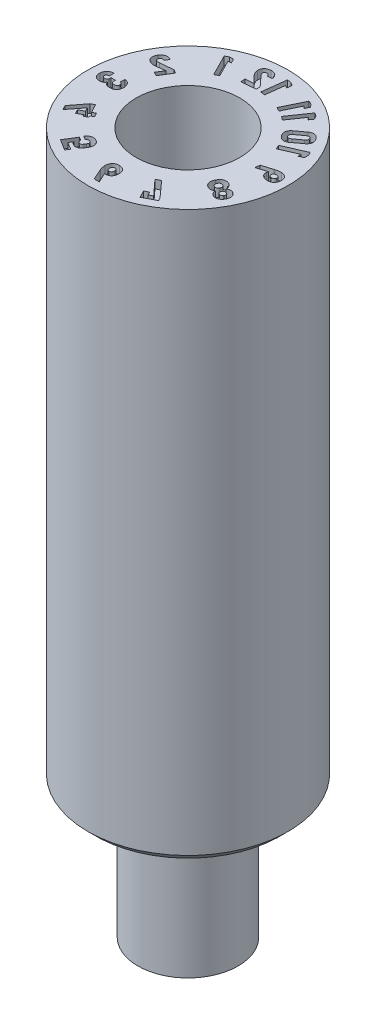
SolidWorks part; units mm, degrees
other "<M3L8-SetScrew>-<Chamfer1>" parameters "D10"=0.24
ref_plane "Front Plane" through (0, 0, 0) normal (0, 0, 1) x (1, 0, 0)
ref_plane "Top Plane" through (0, 0, 0) normal (0, 1, 0) x (1, 0, 0)
ref_plane "Right Plane" through (0, 0, 0) normal (1, 0, 0) x (0, 0, -1)
sketch "Sketch1" plane through (0, 0, 0) normal (0, 0, 1) x (1, 0, 0)
  line L0 (0, 0) -> (0, 20) construction
  line L1 (0, -11) -> (0, 11) construction
  line L2 (1.5, -17) -> (2.76, -17)
  line L4 (3, -16.76) -> (3, 0)
  line L5 (3, 0) -> (1.55, 0)
  line L6 (1.55, 0) -> (1.55, -2.8)
  line L7 (1.55, -2.8) -> (0.8, -2.8)
  line L8 (0.8, -2.8) -> (0.8, -13)
  line L9 (0.8, -13) -> (1.5, -13)
  line L10 (1.5, -13) -> (1.5, -17)
  line L11 (2.76, -17) -> (3, -16.76)
  point P6 (3, -17)
  dimension "D1" = 2.8
  dimension "D2" = 4
  dimension "D3" = 1.6
  dimension "D4" = 3.1
  dimension "D5" = 6
  dimension "D6" = 3
  dimension "D7" = 17
revolve "Revolve1" add sketch "Sketch1" angle 360 about L0
sketch "Sketch2" plane through (0, 0, 0) normal (0, 1, 0) x (1, 0, 0)
  line L0 (0, 0) -> (0, 2.1482) construction
  line L1 (0, 0) -> (1.0741, 1.8604) construction
  line L2 (0, 0) -> (1.8604, 1.0741) construction
  line L3 (0, 0) -> (2.1482, 0) construction
  line L4 (0, 0) -> (1.8604, -1.0741) construction
  line L5 (0, 0) -> (1.0741, -1.8604) construction
  line L6 (0, 0) -> (0, -2.1482) construction
  line L7 (0, 0) -> (-1.0741, -1.8604) construction
  line L8 (0, 0) -> (-1.8604, -1.0741) construction
  line L9 (0, 0) -> (-2.1482, 0) construction
  line L10 (0, 0) -> (-1.8604, 1.0741) construction
  line L11 (0, 0) -> (-1.0741, 1.8604) construction
  line L12 (-0.2616, -2.2179) -> (-0.2616, -2.2184)
  line L13 (-0.2164, -2.4193) -> (-0.0775, -2.7325)
  line L14 (-0.0775, -2.7325) -> (0.076, -2.7361)
  line L15 (0.076, -2.7361) -> (-0.0593, -2.4381)
  line L17 (0.1597, -2.2307) -> (0.1597, -2.2302)
  line L18 (0.0243, -2.2186) -> (0.0242, -2.2191)
  line L19 (-0.1259, -2.2151) -> (-0.1258, -2.2146)
  line L20 (1.4101, -2.2492) -> (0.9731, -1.7642)
  line L21 (0.9731, -1.7642) -> (0.8422, -1.8326)
  line L22 (0.8422, -1.8326) -> (1.2559, -2.2838)
  line L23 (1.2559, -2.2838) -> (1.1458, -2.3415)
  line L24 (1.1458, -2.3415) -> (1.0953, -2.245)
  line L25 (1.0953, -2.245) -> (0.9747, -2.3083)
  line L26 (0.9747, -2.3083) -> (1.0861, -2.521)
  line L27 (1.0861, -2.521) -> (1.4521, -2.3294)
  line L28 (1.4521, -2.3294) -> (1.4101, -2.2492)
  line L29 (1.8365, -1.236) -> (1.8469, -1.2415)
  line L30 (2.1309, -1.3756) -> (2.1474, -1.3844)
  line L31 (2.3472, -1.0088) -> (2.3306, -1)
  line L32 (2.0605, -0.8397) -> (2.0501, -0.8342)
  line L33 (2.004, -0.963) -> (2.0101, -0.9661)
  line L34 (1.9231, -1.1287) -> (1.9165, -1.1253)
  line L35 (2.2623, -1.1171) -> (2.2683, -1.1202)
  line L36 (2.1953, -1.2568) -> (2.1888, -1.2534)
  line L38 (2.5285, -0.1797) -> (2.5289, -0.1798)
  line L39 (2.5667, 0.2381) -> (2.5663, 0.2381)
  line L40 (2.3677, 0.2067) -> (2.0498, 0.1085)
  line L41 (2.0498, 0.1085) -> (2.0361, -0.0337)
  line L42 (2.0361, -0.0337) -> (2.348, 0.0684)
  line L43 (2.5596, 0.1032) -> (2.5602, 0.103)
  line L44 (2.5454, -0.0455) -> (2.5449, -0.0455)
  line L45 (1.814, 0.8994) -> (1.8691, 0.775)
  line L46 (1.8691, 0.775) -> (2.3826, 1.0024)
  line L47 (2.3826, 1.0024) -> (2.3878, 0.9088)
  line L48 (2.3878, 0.9088) -> (2.5198, 0.9672)
  line L49 (2.5198, 0.9672) -> (2.5207, 1.0852)
  line L50 (2.5207, 1.0852) -> (2.4737, 1.1913)
  line L51 (2.4737, 1.1913) -> (1.814, 0.8994)
  line L52 (1.903, 1.1411) -> (2.167, 1.3365)
  line L53 (1.9098, 1.6842) -> (1.6458, 1.4888)
  line L54 (1.7547, 1.4001) -> (1.9629, 1.5541)
  line L55 (2.0582, 1.4254) -> (1.8499, 1.2713)
  line L56 (1.1048, 1.6921) -> (1.2166, 1.6145)
  line L57 (1.2166, 1.6145) -> (1.5375, 2.0767)
  line L58 (1.5375, 2.0767) -> (1.5907, 1.9989)
  line L59 (1.5907, 1.9989) -> (1.6733, 2.1178)
  line L60 (1.6733, 2.1178) -> (1.6124, 2.2193)
  line L61 (1.6124, 2.2193) -> (1.5169, 2.2856)
  line L62 (1.5169, 2.2856) -> (1.1048, 1.6921)
  line L63 (0.8091, 1.8542) -> (0.9319, 1.7951)
  line L64 (0.9319, 1.7951) -> (1.1761, 2.3024)
  line L65 (1.1761, 2.3024) -> (1.241, 2.2342)
  line L66 (1.241, 2.2342) -> (1.3039, 2.3646)
  line L67 (1.3039, 2.3646) -> (1.2276, 2.4553)
  line L68 (1.2276, 2.4553) -> (1.1228, 2.5058)
  line L69 (1.1228, 2.5058) -> (0.8091, 1.8542)
  line L70 (0.1607, 2.0186) -> (0.2951, 2.002)
  line L71 (0.2951, 2.002) -> (0.3642, 2.5573)
  line L72 (0.3642, 2.5573) -> (0.447, 2.5135)
  line L73 (0.447, 2.5135) -> (0.4647, 2.6562)
  line L74 (0.4647, 2.6562) -> (0.3642, 2.7176)
  line L75 (0.3642, 2.7176) -> (0.2495, 2.7319)
  line L76 (0.2495, 2.7319) -> (0.1607, 2.0186)
  line L77 (0.0152, 2.146) -> (-0.2613, 2.4483)
  line L78 (-0.3043, 2.5326) -> (-0.3044, 2.5337)
  line L79 (-0.1503, 2.5238) -> (-0.1502, 2.5232)
  line L80 (-0.1502, 2.5232) -> (-0.0111, 2.5358)
  line L81 (-0.0111, 2.5358) -> (-0.0112, 2.5363)
  line L82 (-0.4445, 2.5249) -> (-0.4444, 2.5244)
  line L83 (-0.3627, 2.3458) -> (-0.1653, 2.1379)
  line L84 (-0.1653, 2.1379) -> (-0.4113, 2.1155)
  line L85 (-0.4113, 2.1155) -> (-0.3993, 1.9848)
  line L86 (-0.3993, 1.9848) -> (0.0264, 2.0236)
  line L87 (0.0264, 2.0236) -> (0.0152, 2.146)
  line L88 (-0.9942, 1.7639) -> (-0.8736, 1.8252)
  line L89 (-0.8736, 1.8252) -> (-1.1266, 2.3234)
  line L90 (-1.1266, 2.3234) -> (-1.0338, 2.3335)
  line L91 (-1.0338, 2.3335) -> (-1.0988, 2.4615)
  line L92 (-1.0988, 2.4615) -> (-1.2162, 2.4561)
  line L93 (-1.2162, 2.4561) -> (-1.3192, 2.4038)
  line L94 (-1.3192, 2.4038) -> (-0.9942, 1.7639)
  line L95 (-1.7103, 1.2951) -> (-2.1158, 1.2558)
  line L96 (-2.2086, 1.2719) -> (-2.2095, 1.2724)
  line L97 (-2.1097, 1.389) -> (-2.1093, 1.3888)
  line L98 (-2.1093, 1.3888) -> (-2.0362, 1.5069)
  line L99 (-2.0362, 1.5069) -> (-2.0367, 1.5072)
  line L100 (-2.2861, 1.1559) -> (-2.2857, 1.1556)
  line L101 (-2.0949, 1.1139) -> (-1.8118, 1.1471)
  line L102 (-1.8118, 1.1471) -> (-1.9408, 0.938)
  line L103 (-1.9408, 0.938) -> (-1.8298, 0.8694)
  line L104 (-1.8298, 0.8694) -> (-1.6065, 1.231)
  line L105 (-1.6065, 1.231) -> (-1.7103, 1.2951)
  line L106 (-2.1972, 0.3095) -> (-2.2021, 0.1694)
  line L107 (-2.22, 0.0132) -> (-2.2369, 0.0138)
  line L108 (-2.3203, 0.0827) -> (-2.318, 0.1436)
  line L109 (-2.318, 0.1436) -> (-2.4488, 0.1482)
  line L110 (-2.4488, 0.1482) -> (-2.451, 0.0873)
  line L111 (-2.5271, 0.0359) -> (-2.5396, 0.0364)
  line L112 (-2.5245, 0.1693) -> (-2.5195, 0.309)
  line L113 (-2.5585, -0.1087) -> (-2.5368, -0.1094)
  line L114 (-2.2316, -0.1321) -> (-2.2098, -0.1329)
  line L115 (-2.0917, -0.8458) -> (-2.4153, -1.2665)
  line L116 (-2.4153, -1.2665) -> (-2.344, -1.4017)
  line L117 (-2.344, -1.4017) -> (-2.0228, -0.9891)
  line L118 (-2.0228, -0.9891) -> (-1.9618, -1.1047)
  line L119 (-1.8725, -1.2739) -> (-1.7573, -1.2132)
  line L120 (-1.7573, -1.2132) -> (-1.7834, -1.1636)
  line L121 (-1.9817, -0.7879) -> (-2.0917, -0.8458)
  line L122 (-2.1223, -1.1894) -> (-2.0593, -1.309)
  line L123 (-2.0593, -1.309) -> (-1.8987, -1.2244)
  line L124 (-1.6857, -1.1121) -> (-1.7488, -0.9924)
  line L125 (-1.7488, -0.9924) -> (-1.8466, -1.0439)
  line L126 (-1.3439, -1.7787) -> (-1.344, -1.779)
  line L127 (-1.344, -1.779) -> (-1.2284, -1.8501)
  line L128 (-1.2284, -1.8501) -> (-1.2282, -1.8498)
  line L129 (-1.1017, -1.934) -> (-1.1334, -1.9855)
  line L130 (-1.2738, -1.9369) -> (-1.3817, -1.8705)
  line L131 (-1.3817, -1.8705) -> (-1.5986, -2.223)
  line L132 (-1.5986, -2.223) -> (-1.2694, -2.4257)
  line L133 (-1.2694, -2.4257) -> (-1.2009, -2.3144)
  line L134 (-1.2009, -2.3144) -> (-1.4146, -2.1828)
  line L135 (-1.4146, -2.1828) -> (-1.3479, -2.0743)
  line L136 (-1.0177, -2.0566) -> (-0.986, -2.0051)
  line L137 (-1.8466, -1.0439) -> (-1.9817, -0.7879)
  line L138 (-1.7834, -1.1636) -> (-1.6857, -1.1121)
  line L139 (-1.8987, -1.2244) -> (-1.8725, -1.2739)
  line L140 (-1.9618, -1.1047) -> (-2.1223, -1.1894)
  circle A0 centre (0, 0) radius 2.03 construction
  spline S0 degree 3 poles (-0.0461, -2.0054) (-0.0667, -2.0048) (-0.0971, -2.0069) (-0.1351, -2.017) (-0.1604, -2.0276) (-0.1832, -2.0413) (-0.2032, -2.0583) (-0.2205, -2.0781) (-0.2348, -2.101) (-0.2464, -2.1265) (-0.2578, -2.1654) (-0.261, -2.1966) (-0.2616, -2.2179) knots 0 0 0 0 0.180487 0.262905 0.341887 0.419019 0.494168 0.569775 0.647705 0.728495 0.813324 1 1 1 1
  spline S1 degree 3 poles (-0.2616, -2.2184) (-0.262, -2.2318) (-0.2611, -2.2524) (-0.2578, -2.2801) (-0.2502, -2.3245) (-0.2392, -2.361) (-0.2285, -2.3896) knots 0 0 0 0 0.23009 0.351367 0.476379 1 1 1 1
  spline S2 degree 3 poles (-0.2285, -2.3896) (-0.2266, -2.3946) (-0.2226, -2.4045) (-0.2186, -2.4144) (-0.2164, -2.4193) knots 0 0 0 0 0.502223 1 1 1 1
  spline S3 degree 3 poles (-0.0593, -2.4381) (-0.0507, -2.4401) (-0.0418, -2.441) (-0.0329, -2.4412) knots 0.756686 0.756686 0.756686 0.756686 1 1 1 1
  spline S4 degree 3 poles (-0.0329, -2.4412) (-0.0145, -2.4415) (0.0128, -2.4397) (0.0468, -2.4296) (0.0694, -2.419) (0.0896, -2.4053) (0.1076, -2.3886) (0.1229, -2.3688) (0.1359, -2.3463) (0.1459, -2.3209) (0.1562, -2.2825) (0.1592, -2.2517) (0.1597, -2.2307) knots 0 0 0 0 0.171279 0.250478 0.326847 0.401564 0.476177 0.552821 0.63221 0.716132 0.804689 1 1 1 1
  spline S5 degree 3 poles (0.1597, -2.2302) (0.1603, -2.2086) (0.1583, -2.1771) (0.1488, -2.1372) (0.1385, -2.1108) (0.1253, -2.087) (0.1089, -2.0661) (0.0897, -2.048) (0.0675, -2.0332) (0.0428, -2.0211) (0.005, -2.0094) (-0.0253, -2.0059) (-0.0461, -2.0054) knots 0 0 0 0 0.187076 0.27229 0.35342 0.43179 0.507436 0.58253 0.658929 0.73766 0.820035 1 1 1 1
  spline S6 degree 3 poles (-0.0492, -2.1361) (-0.0384, -2.1364) (-0.0225, -2.1386) (-0.0043, -2.1484) (0.0065, -2.1581) (0.0148, -2.1702) (0.023, -2.1902) (0.0244, -2.2071) (0.0243, -2.2186) knots 0 0 0 0 0.259294 0.374786 0.487745 0.602728 0.722941 1 1 1 1
  spline S7 degree 3 poles (0.0242, -2.2191) (0.0238, -2.2323) (0.0217, -2.2515) (0.0126, -2.2741) (0.0037, -2.2875) (-0.0076, -2.2979) (-0.0261, -2.3082) (-0.0424, -2.3102) (-0.0533, -2.31) knots 0 0 0 0 0.294554 0.41993 0.536573 0.647616 0.758511 1 1 1 1
  spline S8 degree 3 poles (-0.0533, -2.31) (-0.064, -2.3097) (-0.08, -2.3068) (-0.0978, -2.2955) (-0.1085, -2.2843) (-0.1168, -2.2704) (-0.1248, -2.2474) (-0.1261, -2.2283) (-0.1259, -2.2151) knots 0 0 0 0 0.240392 0.350327 0.462502 0.581497 0.70716 1 1 1 1
  spline S9 degree 3 poles (-0.1258, -2.2146) (-0.1254, -2.2031) (-0.1236, -2.1862) (-0.1142, -2.1669) (-0.1054, -2.1553) (-0.0942, -2.1462) (-0.0757, -2.1376) (-0.0599, -2.1359) (-0.0492, -2.1361) knots 0 0 0 0 0.278086 0.398319 0.51325 0.626627 0.741414 1 1 1 1
  spline S10 degree 3 poles (1.7672, -0.9415) (1.757, -0.9603) (1.7449, -0.9895) (1.7353, -1.0295) (1.7322, -1.0583) (1.7328, -1.0862) (1.7369, -1.113) (1.7449, -1.1383) (1.7565, -1.1621) (1.7716, -1.1842) (1.7966, -1.2112) (1.8198, -1.2271) (1.8365, -1.236) knots 0 0 0 0 0.18897 0.276486 0.361509 0.443508 0.521971 0.599279 0.676736 0.754734 0.833659 1 1 1 1
  spline S11 degree 3 poles (1.8469, -1.2415) (1.8625, -1.2497) (1.8876, -1.2592) (1.9231, -1.2636) (1.9502, -1.2634) (1.9772, -1.2597) (2.0119, -1.2499) (2.0359, -1.2372) (2.0503, -1.2266) knots 0 0 0 0 0.246329 0.370315 0.497535 0.62533 0.749846 1 1 1 1
  spline S12 degree 3 poles (2.0503, -1.2266) (2.0498, -1.2419) (2.0518, -1.2649) (2.0607, -1.294) (2.0702, -1.3146) (2.0821, -1.3337) (2.1008, -1.3559) (2.1182, -1.369) (2.1309, -1.3756) knots 0 0 0 0 0.257651 0.384184 0.511783 0.638602 0.760307 1 1 1 1
  spline S13 degree 3 poles (2.1474, -1.3844) (2.1631, -1.3928) (2.1877, -1.4026) (2.2219, -1.4081) (2.247, -1.4081) (2.2718, -1.4048) (2.2959, -1.3978) (2.319, -1.3872) (2.341, -1.3731) (2.3619, -1.3558) (2.3882, -1.3278) (2.4042, -1.303) (2.4136, -1.2853) knots 0 0 0 0 0.16683 0.245777 0.324096 0.401918 0.4796 0.558252 0.640011 0.724439 0.811989 1 1 1 1
  spline S14 degree 3 poles (2.4136, -1.2853) (2.423, -1.2675) (2.4345, -1.2403) (2.4432, -1.2028) (2.446, -1.1759) (2.4452, -1.1496) (2.4412, -1.1245) (2.4335, -1.1006) (2.4225, -1.0782) (2.4082, -1.0576) (2.3847, -1.0321) (2.3628, -1.0172) (2.3472, -1.0088) knots 0 0 0 0 0.188229 0.275566 0.360293 0.441772 0.521034 0.598441 0.676256 0.754274 0.833194 1 1 1 1
  spline S15 degree 3 poles (2.3306, -1) (2.3178, -0.9933) (2.297, -0.9858) (2.2677, -0.983) (2.2452, -0.9839) (2.2228, -0.988) (2.1936, -0.9972) (2.1737, -1.0089) (2.1613, -1.0179) knots 0 0 0 0 0.242557 0.363888 0.489817 0.617581 0.743593 1 1 1 1
  spline S16 degree 3 poles (2.1613, -1.0179) (2.1617, -0.9999) (2.1591, -0.9727) (2.1479, -0.9381) (2.1359, -0.9136) (2.1212, -0.8907) (2.0977, -0.8638) (2.0761, -0.848) (2.0605, -0.8397) knots 0 0 0 0 0.251434 0.376949 0.504345 0.631102 0.754753 1 1 1 1
  spline S17 degree 3 poles (2.0501, -0.8342) (2.0334, -0.8254) (2.0073, -0.815) (1.9709, -0.8094) (1.9442, -0.8092) (1.918, -0.8128) (1.8926, -0.8206) (1.8679, -0.8318) (1.8445, -0.8471) (1.8224, -0.8657) (1.7944, -0.8959) (1.7775, -0.9226) (1.7672, -0.9415) knots 0 0 0 0 0.166427 0.245105 0.322921 0.400592 0.477743 0.556383 0.638281 0.72323 0.810829 1 1 1 1
  spline S18 degree 3 poles (1.8823, -1.0026) (1.8862, -0.9949) (1.8935, -0.9845) (1.9049, -0.9724) (1.9145, -0.9652) (1.9245, -0.9592) (1.9351, -0.955) (1.9462, -0.9522) (1.9576, -0.951) (1.9693, -0.9515) (1.9852, -0.9545) (1.9966, -0.959) (2.004, -0.963) knots 0 0 0 0 0.179146 0.263485 0.346183 0.426847 0.50599 0.583997 0.663781 0.744696 0.826122 1 1 1 1
  spline S19 degree 3 poles (2.0101, -0.9661) (2.0167, -0.9699) (2.0263, -0.9761) (2.0364, -0.9871) (2.0424, -0.996) (2.047, -1.0058) (2.0502, -1.016) (2.0519, -1.0269) (2.0522, -1.0382) (2.0511, -1.0499) (2.0473, -1.0661) (2.0424, -1.0779) (2.0382, -1.0856) knots 0 0 0 0 0.166618 0.24514 0.322785 0.400255 0.477987 0.556509 0.63825 0.723639 0.810934 1 1 1 1
  spline S20 degree 3 poles (2.0382, -1.0856) (2.0343, -1.0933) (2.0271, -1.1039) (2.0158, -1.116) (2.0068, -1.1235) (1.9972, -1.1296) (1.9872, -1.1343) (1.9768, -1.1373) (1.9662, -1.1388) (1.9553, -1.1389) (1.9405, -1.1365) (1.9298, -1.1324) (1.9231, -1.1287) knots 0 0 0 0 0.188385 0.275437 0.359734 0.441506 0.521092 0.597976 0.675844 0.753871 0.8335 1 1 1 1
  spline S21 degree 3 poles (1.9165, -1.1253) (1.9094, -1.1212) (1.8989, -1.1147) (1.8879, -1.1029) (1.881, -1.0936) (1.8756, -1.0835) (1.8718, -1.0729) (1.8696, -1.0616) (1.8691, -1.05) (1.87, -1.0382) (1.8733, -1.0219) (1.8782, -1.0102) (1.8823, -1.0026) knots 0 0 0 0 0.174008 0.254956 0.335884 0.415131 0.49334 0.572242 0.653526 0.73586 0.820553 1 1 1 1
  spline S22 degree 3 poles (2.1541, -1.1472) (2.1577, -1.1409) (2.1635, -1.1316) (2.1738, -1.1219) (2.1819, -1.1158) (2.1907, -1.1111) (2.2001, -1.1078) (2.2099, -1.1058) (2.2202, -1.1051) (2.2306, -1.1061) (2.2451, -1.109) (2.2555, -1.1135) (2.2623, -1.1171) knots 0 0 0 0 0.173604 0.254823 0.334917 0.413038 0.490953 0.56999 0.650544 0.733856 0.818322 1 1 1 1
  spline S23 degree 3 poles (2.2683, -1.1202) (2.2747, -1.1235) (2.2834, -1.1295) (2.2933, -1.1392) (2.2991, -1.1472) (2.3039, -1.1556) (2.307, -1.1647) (2.3091, -1.174) (2.3097, -1.1838) (2.309, -1.1937) (2.3064, -1.2076) (2.302, -1.2175) (2.2987, -1.224) knots 0 0 0 0 0.176567 0.258755 0.339518 0.419325 0.496432 0.574252 0.653566 0.735947 0.819395 1 1 1 1
  spline S24 degree 3 poles (2.2987, -1.224) (2.295, -1.2303) (2.2894, -1.2397) (2.2793, -1.2495) (2.2715, -1.2558) (2.263, -1.2605) (2.2542, -1.2643) (2.2447, -1.2664) (2.2351, -1.2673) (2.2252, -1.2669) (2.2115, -1.2641) (2.2016, -1.2603) (2.1953, -1.2568) knots 0 0 0 0 0.180109 0.263225 0.345083 0.424547 0.502951 0.580095 0.659622 0.740301 0.823495 1 1 1 1
  spline S25 degree 3 poles (2.1888, -1.2534) (2.1822, -1.2498) (2.1728, -1.2438) (2.1625, -1.2335) (2.1561, -1.2253) (2.1509, -1.2165) (2.1469, -1.2074) (2.1446, -1.1977) (2.1435, -1.1878) (2.1441, -1.1776) (2.1466, -1.1637) (2.1507, -1.1536) (2.1541, -1.1472) knots 0 0 0 0 0.178886 0.263364 0.346451 0.427134 0.505659 0.58395 0.66333 0.743411 0.825134 1 1 1 1
  spline S26 degree 3 poles (2.348, 0.0684) (2.3477, 0.0679) (2.3457, 0.0628) (2.3407, 0.0474) (2.3379, 0.0321) (2.337, 0.0215) knots 0.564855 0.564855 0.564855 0.564855 0.580984 0.712931 1 1 1 1
  spline S27 degree 3 poles (2.337, 0.0215) (2.3354, 0.0045) (2.3357, -0.0211) (2.3439, -0.0536) (2.3532, -0.0761) (2.3657, -0.097) (2.3813, -0.1158) (2.3998, -0.1326) (2.4211, -0.1471) (2.4447, -0.1594) (2.4803, -0.1725) (2.5088, -0.1779) (2.5285, -0.1797) knots 0 0 0 0 0.165089 0.242872 0.320548 0.398089 0.475522 0.554823 0.636889 0.722225 0.81037 1 1 1 1
  spline S28 degree 3 poles (2.5289, -0.1798) (2.5504, -0.1817) (2.582, -0.1824) (2.6224, -0.1755) (2.6494, -0.1672) (2.674, -0.1559) (2.696, -0.1411) (2.7152, -0.1232) (2.7318, -0.1024) (2.7453, -0.0786) (2.7599, -0.0422) (2.7655, -0.0123) (2.7674, 0.0083) knots 0 0 0 0 0.187573 0.272963 0.35432 0.432514 0.507929 0.583311 0.659523 0.738131 0.819963 1 1 1 1
  spline S29 degree 3 poles (2.7674, 0.0083) (2.7694, 0.0288) (2.7697, 0.0591) (2.762, 0.0976) (2.753, 0.1235) (2.7405, 0.1472) (2.7248, 0.1683) (2.7058, 0.187) (2.6836, 0.2029) (2.6584, 0.216) (2.6198, 0.2305) (2.5884, 0.2359) (2.5667, 0.2381) knots 0 0 0 0 0.178225 0.259676 0.338605 0.415105 0.490318 0.566055 0.644473 0.7259 0.811371 1 1 1 1
  spline S30 degree 3 poles (2.5663, 0.2381) (2.5538, 0.2395) (2.5346, 0.2396) (2.5085, 0.238) (2.4877, 0.2354) (2.466, 0.2315) (2.435, 0.2254) (2.4116, 0.2191) (2.3957, 0.2148) knots 0 0 0 0 0.216605 0.332099 0.453212 0.58005 0.713794 1 1 1 1
  spline S31 degree 3 poles (2.3957, 0.2148) (2.3909, 0.2137) (2.3814, 0.2114) (2.3722, 0.2082) (2.3677, 0.2067) knots 0 0 0 0 0.506664 1 1 1 1
  spline S32 degree 3 poles (2.4652, 0.0373) (2.4661, 0.048) (2.4702, 0.0634) (2.4818, 0.0807) (2.4931, 0.0905) (2.5067, 0.0979) (2.529, 0.1043) (2.5472, 0.1043) (2.5596, 0.1032) knots 0 0 0 0 0.246182 0.358981 0.471206 0.587818 0.712037 1 1 1 1
  spline S33 degree 3 poles (2.5602, 0.103) (2.5721, 0.1018) (2.5894, 0.0985) (2.6091, 0.088) (2.6206, 0.0782) (2.6293, 0.0663) (2.6373, 0.0474) (2.6382, 0.0315) (2.637, 0.0209) knots 0 0 0 0 0.283769 0.405536 0.521861 0.634897 0.748377 1 1 1 1
  spline S34 degree 3 poles (2.637, 0.0209) (2.6358, 0.0102) (2.6324, -0.0056) (2.6208, -0.0228) (2.6098, -0.0327) (2.5966, -0.0401) (2.575, -0.0465) (2.5574, -0.0468) (2.5454, -0.0455) knots 0 0 0 0 0.252915 0.365936 0.478495 0.595136 0.71668 1 1 1 1
  spline S35 degree 3 poles (2.5449, -0.0455) (2.5325, -0.0443) (2.5147, -0.0406) (2.4941, -0.0303) (2.4822, -0.0205) (2.473, -0.0086) (2.4651, 0.0106) (2.4639, 0.0266) (2.4652, 0.0373) knots 0 0 0 0 0.2876 0.410656 0.527362 0.638814 0.751354 1 1 1 1
  spline S36 degree 3 poles (1.6094, 1.1928) (1.6193, 1.1795) (1.6349, 1.1608) (1.658, 1.1393) (1.6753, 1.126) (1.693, 1.1148) (1.7112, 1.106) (1.7298, 1.0996) (1.7488, 1.0953) (1.768, 1.0936) (1.7873, 1.0937) (1.8066, 1.0962) (1.826, 1.1009) (1.8454, 1.1075) (1.8718, 1.1201) (1.8908, 1.1319) (1.903, 1.1411) knots 0 0 0 0 0.147117 0.214402 0.278561 0.339909 0.398973 0.456512 0.51374 0.57063 0.626826 0.684108 0.742238 0.802596 0.865353 1 1 1 1
  spline S37 degree 3 poles (2.167, 1.3365) (2.1793, 1.3458) (2.1967, 1.3602) (2.2162, 1.3822) (2.2286, 1.3987) (2.2386, 1.4159) (2.2464, 1.4337) (2.2524, 1.4521) (2.2559, 1.4711) (2.2574, 1.4905) (2.2566, 1.5102) (2.2535, 1.5301) (2.248, 1.5502) (2.2403, 1.5706) (2.2263, 1.5987) (2.2134, 1.6192) (2.2034, 1.6324) knots 0 0 0 0 0.136047 0.198883 0.259431 0.317603 0.374632 0.431247 0.487747 0.544883 0.602554 0.661504 0.722654 0.78644 0.853707 1 1 1 1
  spline S38 degree 3 poles (2.2034, 1.6324) (2.1935, 1.6458) (2.1779, 1.6645) (2.1548, 1.686) (2.1376, 1.6994) (2.1201, 1.7107) (2.1019, 1.7194) (2.0835, 1.726) (2.0646, 1.7304) (2.0455, 1.7323) (2.0263, 1.7321) (2.0069, 1.7299) (1.9876, 1.7249) (1.9681, 1.7181) (1.9414, 1.7056) (1.9222, 1.6935) (1.9098, 1.6842) knots 0 0 0 0 0.146929 0.214129 0.277956 0.33934 0.397903 0.455386 0.51208 0.56839 0.624514 0.681549 0.739824 0.80036 0.863359 1 1 1 1
  spline S39 degree 3 poles (1.6458, 1.4888) (1.6335, 1.4795) (1.6161, 1.4651) (1.5966, 1.4431) (1.5842, 1.4266) (1.5743, 1.4092) (1.5661, 1.3915) (1.5604, 1.373) (1.5566, 1.3541) (1.5552, 1.3348) (1.5561, 1.3151) (1.5593, 1.2952) (1.5648, 1.2751) (1.5725, 1.2547) (1.5864, 1.2265) (1.5994, 1.2061) (1.6094, 1.1928) knots 0 0 0 0 0.136019 0.198842 0.259378 0.317958 0.375029 0.431628 0.488072 0.545196 0.602448 0.661574 0.722711 0.786484 0.853737 1 1 1 1
  spline S40 degree 3 poles (1.7148, 1.2709) (1.7109, 1.2761) (1.7062, 1.2842) (1.7012, 1.2955) (1.6991, 1.3038) (1.6978, 1.312) (1.6979, 1.3202) (1.699, 1.3284) (1.7019, 1.3395) (1.7086, 1.3534) (1.7253, 1.3761) (1.7422, 1.3907) (1.7547, 1.4001) knots 0 0 0 0 0.125725 0.183945 0.238714 0.292444 0.345219 0.398346 0.452716 0.568249 0.696065 1 1 1 1
  spline S41 degree 3 poles (1.9629, 1.5541) (1.9754, 1.5635) (1.9944, 1.5752) (2.021, 1.5846) (2.0388, 1.5871) (2.0559, 1.5856) (2.0778, 1.5771) (2.0908, 1.5641) (2.0979, 1.5544) knots 0 0 0 0 0.305311 0.43194 0.547296 0.654391 0.761589 1 1 1 1
  spline S42 degree 3 poles (2.0979, 1.5544) (2.1019, 1.5492) (2.1067, 1.5411) (2.1116, 1.5298) (2.1139, 1.5215) (2.1149, 1.5133) (2.1149, 1.5051) (2.1138, 1.4969) (2.1109, 1.4859) (2.1041, 1.4721) (2.0879, 1.4491) (2.0704, 1.4349) (2.0582, 1.4254) knots 0 0 0 0 0.125814 0.184074 0.239386 0.292755 0.345568 0.398732 0.45314 0.567811 0.695414 1 1 1 1
  spline S43 degree 3 poles (1.8499, 1.2713) (1.8374, 1.2621) (1.8185, 1.25) (1.7918, 1.2409) (1.774, 1.2382) (1.757, 1.2397) (1.7351, 1.2482) (1.722, 1.2611) (1.7148, 1.2709) knots 0 0 0 0 0.304488 0.431839 0.547543 0.654592 0.760791 1 1 1 1
  spline S44 degree 3 poles (-0.2613, 2.4483) (-0.2732, 2.4608) (-0.2856, 2.4785) (-0.2964, 2.5013) (-0.3015, 2.5151) (-0.3036, 2.5257) (-0.3043, 2.5326) knots 0 0 0 0 0.53955 0.66565 0.783202 1 1 1 1
  spline S45 degree 3 poles (-0.3044, 2.5337) (-0.3052, 2.5424) (-0.3046, 2.5556) (-0.2976, 2.5711) (-0.2899, 2.5808) (-0.28, 2.5887) (-0.263, 2.5976) (-0.248, 2.5999) (-0.2377, 2.6011) knots 0 0 0 0 0.245619 0.358314 0.46938 0.58591 0.710099 1 1 1 1
  spline S46 degree 3 poles (-0.2377, 2.6011) (-0.2274, 2.6023) (-0.2119, 2.6009) (-0.1929, 2.5933) (-0.1808, 2.5843) (-0.1703, 2.5728) (-0.1582, 2.5531) (-0.1529, 2.5359) (-0.1503, 2.5238) knots 0 0 0 0 0.240793 0.353898 0.468452 0.587551 0.713116 1 1 1 1
  spline S47 degree 3 poles (-0.0112, 2.5363) (-0.0144, 2.5574) (-0.0221, 2.5877) (-0.0385, 2.6249) (-0.0534, 2.6493) (-0.0708, 2.6709) (-0.0905, 2.6894) (-0.1124, 2.7048) (-0.1363, 2.7171) (-0.1622, 2.7259) (-0.1997, 2.7337) (-0.229, 2.7338) (-0.2487, 2.732) knots 0 0 0 0 0.185577 0.271291 0.354122 0.434342 0.512451 0.589112 0.667053 0.74636 0.827362 1 1 1 1
  spline S48 degree 3 poles (-0.2487, 2.732) (-0.2695, 2.73) (-0.2999, 2.7251) (-0.3372, 2.7119) (-0.3616, 2.7001) (-0.3833, 2.686) (-0.4017, 2.6691) (-0.4172, 2.6502) (-0.4293, 2.6289) (-0.4383, 2.6056) (-0.446, 2.5708) (-0.4461, 2.5434) (-0.4445, 2.5249) knots 0 0 0 0 0.194757 0.282954 0.366363 0.445797 0.521795 0.596412 0.671721 0.748251 0.827508 1 1 1 1
  spline S49 degree 3 poles (-0.4444, 2.5244) (-0.4429, 2.508) (-0.4386, 2.4835) (-0.4283, 2.4519) (-0.4188, 2.4284) (-0.4072, 2.4058) (-0.3897, 2.3774) (-0.3743, 2.3577) (-0.3627, 2.3458) knots 0 0 0 0 0.246099 0.371171 0.498698 0.625929 0.751174 1 1 1 1
  spline S50 degree 3 poles (-2.1158, 1.2558) (-2.133, 1.2537) (-2.1544, 1.2543) (-2.1789, 1.2596) (-2.193, 1.2636) (-2.2027, 1.2683) (-2.2086, 1.2719) knots 0 0 0 0 0.540702 0.664976 0.78319 1 1 1 1
  spline S51 degree 3 poles (-2.2095, 1.2724) (-2.217, 1.2769) (-2.2269, 1.2855) (-2.2352, 1.3002) (-2.2383, 1.3121) (-2.2386, 1.3248) (-2.2352, 1.3435) (-2.2285, 1.3568) (-2.2232, 1.3656) knots 0 0 0 0 0.245398 0.358007 0.470247 0.586897 0.710409 1 1 1 1
  spline S52 degree 3 poles (-2.2232, 1.3656) (-2.2179, 1.3745) (-2.2077, 1.3862) (-2.1903, 1.3965) (-2.176, 1.401) (-2.1606, 1.4026) (-2.1377, 1.4002) (-2.1208, 1.3944) (-2.1097, 1.389) knots 0 0 0 0 0.240807 0.353882 0.468215 0.586575 0.713104 1 1 1 1
  spline S53 degree 3 poles (-2.0367, 1.5072) (-2.0554, 1.5171) (-2.084, 1.5292) (-2.1234, 1.5382) (-2.1516, 1.5411) (-2.1791, 1.5401) (-2.2056, 1.5355) (-2.2309, 1.5273) (-2.255, 1.5156) (-2.2775, 1.5003) (-2.3059, 1.475) (-2.3235, 1.4518) (-2.3338, 1.4351) knots 0 0 0 0 0.185705 0.271104 0.354145 0.434085 0.512204 0.589168 0.666915 0.746128 0.827382 1 1 1 1
  spline S54 degree 3 poles (-2.3338, 1.4351) (-2.345, 1.4174) (-2.3586, 1.3901) (-2.371, 1.3528) (-2.3759, 1.3263) (-2.3774, 1.3006) (-2.3753, 1.2759) (-2.3693, 1.2523) (-2.3596, 1.23) (-2.3464, 1.209) (-2.3236, 1.182) (-2.3017, 1.1658) (-2.2861, 1.1559) knots 0 0 0 0 0.194987 0.283068 0.366389 0.445905 0.522077 0.596907 0.671876 0.748382 0.827624 1 1 1 1
  spline S55 degree 3 poles (-2.2857, 1.1556) (-2.2717, 1.1472) (-2.2497, 1.1358) (-2.2185, 1.1252) (-2.1941, 1.1188) (-2.1693, 1.1144) (-2.1361, 1.1113) (-2.1112, 1.1119) (-2.0949, 1.1139) knots 0 0 0 0 0.246698 0.370907 0.497949 0.625469 0.751175 1 1 1 1
  spline S56 degree 3 poles (-2.0038, 0.0715) (-2.0028, 0.0922) (-2.0047, 0.1228) (-2.0131, 0.1619) (-2.0229, 0.1887) (-2.0351, 0.2135) (-2.0505, 0.2359) (-2.0687, 0.2557) (-2.0897, 0.273) (-2.1131, 0.2873) (-2.1485, 0.3024) (-2.1774, 0.3077) (-2.1972, 0.3095) knots 0 0 0 0 0.181178 0.266513 0.349322 0.42994 0.508235 0.586064 0.664947 0.744986 0.826086 1 1 1 1
  spline S57 degree 3 poles (-2.2021, 0.1694) (-2.1952, 0.168) (-2.185, 0.1657) (-2.1729, 0.1598) (-2.1647, 0.1551) (-2.1577, 0.1492) (-2.1512, 0.1429) (-2.1461, 0.1357) (-2.1417, 0.1279) (-2.1382, 0.1196) (-2.1354, 0.1072) (-2.1346, 0.0975) (-2.1349, 0.0909) knots 0 0 0 0 0.185286 0.27088 0.353217 0.433587 0.512069 0.589712 0.666841 0.745723 0.826751 1 1 1 1
  spline S58 degree 3 poles (-2.1349, 0.0909) (-2.1353, 0.0794) (-2.1382, 0.0626) (-2.1481, 0.0431) (-2.1583, 0.0317) (-2.1707, 0.0227) (-2.1911, 0.0143) (-2.2083, 0.0127) (-2.22, 0.0132) knots 0 0 0 0 0.265368 0.38285 0.497215 0.61263 0.730965 1 1 1 1
  spline S59 degree 3 poles (-2.2369, 0.0138) (-2.249, 0.0145) (-2.2666, 0.0163) (-2.2874, 0.0246) (-2.2997, 0.0325) (-2.3095, 0.0425) (-2.3187, 0.0588) (-2.3207, 0.0731) (-2.3203, 0.0827) knots 0 0 0 0 0.29996 0.427315 0.545362 0.656546 0.764585 1 1 1 1
  spline S60 degree 3 poles (-2.451, 0.0873) (-2.4512, 0.0796) (-2.4536, 0.0678) (-2.4629, 0.0552) (-2.472, 0.0477) (-2.4831, 0.0419) (-2.5015, 0.0364) (-2.5166, 0.0355) (-2.5271, 0.0359) knots 0 0 0 0 0.227135 0.334039 0.446236 0.566504 0.69566 1 1 1 1
  spline S61 degree 3 poles (-2.5396, 0.0364) (-2.5495, 0.0366) (-2.5637, 0.0388) (-2.5806, 0.0461) (-2.5905, 0.0535) (-2.5982, 0.0625) (-2.6056, 0.0772) (-2.607, 0.0898) (-2.6067, 0.0983) knots 0 0 0 0 0.286993 0.4107 0.528599 0.641809 0.752363 1 1 1 1
  spline S62 degree 3 poles (-2.6067, 0.0983) (-2.6065, 0.1042) (-2.6051, 0.113) (-2.6007, 0.1239) (-2.5963, 0.1316) (-2.5908, 0.1387) (-2.5842, 0.1452) (-2.5766, 0.151) (-2.568, 0.1563) (-2.5584, 0.1608) (-2.5439, 0.1657) (-2.5325, 0.1684) (-2.5245, 0.1693) knots 0 0 0 0 0.149492 0.22224 0.296363 0.37217 0.449306 0.529007 0.614119 0.703252 0.797441 1 1 1 1
  spline S63 degree 3 poles (-2.5195, 0.309) (-2.5403, 0.3078) (-2.5708, 0.3033) (-2.6088, 0.2905) (-2.6344, 0.2782) (-2.6576, 0.2632) (-2.6778, 0.2454) (-2.6957, 0.2257) (-2.7104, 0.2034) (-2.7224, 0.1793) (-2.7342, 0.1444) (-2.7379, 0.1167) (-2.7387, 0.0979) knots 0 0 0 0 0.185479 0.271806 0.355939 0.43725 0.516574 0.594676 0.67374 0.753112 0.833161 1 1 1 1
  spline S64 degree 3 poles (-2.7387, 0.0979) (-2.7392, 0.0829) (-2.7386, 0.0608) (-2.7344, 0.0324) (-2.7298, 0.013) (-2.7236, -0.0052) (-2.7158, -0.022) (-2.7063, -0.0375) (-2.6954, -0.0517) (-2.683, -0.0644) (-2.6691, -0.0756) (-2.654, -0.0853) (-2.6374, -0.0932) (-2.6195, -0.0994) (-2.5934, -0.1061) (-2.5726, -0.1082) (-2.5585, -0.1087) knots 0 0 0 0 0.144867 0.211881 0.275575 0.336929 0.396116 0.453826 0.511153 0.567815 0.624598 0.681869 0.740588 0.800637 0.863768 1 1 1 1
  spline S65 degree 3 poles (-2.5368, -0.1094) (-2.521, -0.1098) (-2.4975, -0.1081) (-2.4683, -0.0982) (-2.4484, -0.0878) (-2.4304, -0.0744) (-2.409, -0.0523) (-2.3969, -0.032) (-2.3907, -0.0175) knots 0 0 0 0 0.257526 0.379283 0.5002 0.621078 0.743167 1 1 1 1
  spline S66 degree 3 poles (-2.3907, -0.0175) (-2.3892, -0.026) (-2.3857, -0.0382) (-2.3791, -0.0537) (-2.3729, -0.0643) (-2.3661, -0.0744) (-2.3582, -0.0837) (-2.349, -0.0921) (-2.3392, -0.1001) (-2.3284, -0.1071) (-2.3168, -0.1135) (-2.3044, -0.1187) (-2.2913, -0.1231) (-2.2774, -0.1268) (-2.2576, -0.1306) (-2.2421, -0.1317) (-2.2316, -0.1321) knots 0 0 0 0 0.120493 0.178556 0.235515 0.29269 0.349517 0.407123 0.466376 0.526952 0.588117 0.651327 0.715968 0.78238 0.852241 1 1 1 1
  spline S67 degree 3 poles (-2.2098, -0.1329) (-2.1903, -0.1335) (-2.1615, -0.1321) (-2.1255, -0.1227) (-2.1015, -0.1125) (-2.0798, -0.0995) (-2.0608, -0.0832) (-2.0442, -0.0641) (-2.0305, -0.0419) (-2.0192, -0.0172) (-2.0081, 0.0205) (-2.0044, 0.0507) (-2.0038, 0.0715) knots 0 0 0 0 0.178127 0.259413 0.337774 0.414027 0.48887 0.564471 0.643053 0.724667 0.810865 1 1 1 1
  spline S68 degree 3 poles (-1.0512, -1.7058) (-1.0669, -1.696) (-1.0919, -1.6842) (-1.127, -1.6752) (-1.1533, -1.6724) (-1.1795, -1.6729) (-1.2056, -1.677) (-1.231, -1.6852) (-1.256, -1.6969) (-1.2801, -1.712) (-1.3115, -1.7377) (-1.3316, -1.7615) (-1.3439, -1.7787) knots 0 0 0 0 0.165211 0.244482 0.322752 0.400712 0.478214 0.557427 0.639157 0.723832 0.811062 1 1 1 1
  spline S69 degree 3 poles (-1.2282, -1.8498) (-1.221, -1.8402) (-1.209, -1.8273) (-1.1899, -1.8151) (-1.1757, -1.8096) (-1.1611, -1.8069) (-1.1413, -1.808) (-1.1272, -1.8136) (-1.1187, -1.819) knots 0 0 0 0 0.286716 0.412638 0.532782 0.6481 0.760422 1 1 1 1
  spline S70 degree 3 poles (-1.1187, -1.819) (-1.1094, -1.8245) (-1.0973, -1.835) (-1.087, -1.8532) (-1.0832, -1.8679) (-1.0828, -1.8835) (-1.0867, -1.9067) (-1.0953, -1.9231) (-1.1017, -1.934) knots 0 0 0 0 0.244724 0.357199 0.469812 0.58631 0.7105 1 1 1 1
  spline S71 degree 3 poles (-1.1334, -1.9855) (-1.14, -1.9963) (-1.1509, -2.0109) (-1.1688, -2.0257) (-1.1822, -2.0327) (-1.196, -2.0364) (-1.215, -2.0364) (-1.2286, -2.0313) (-1.2368, -2.0261) knots 0 0 0 0 0.302243 0.431266 0.550453 0.661604 0.768726 1 1 1 1
  spline S72 degree 3 poles (-1.2368, -2.0261) (-1.2446, -2.0214) (-1.2552, -2.0129) (-1.2658, -1.9987) (-1.2717, -1.9875) (-1.2755, -1.9754) (-1.2777, -1.9584) (-1.2762, -1.9454) (-1.2738, -1.9369) knots 0 0 0 0 0.263966 0.385636 0.506873 0.628306 0.747784 1 1 1 1
  spline S73 degree 3 poles (-1.3479, -2.0743) (-1.346, -2.0816) (-1.3415, -2.0925) (-1.3328, -2.1061) (-1.3248, -2.1166) (-1.3155, -2.1264) (-1.3026, -2.1388) (-1.2917, -2.1467) (-1.2842, -2.1513) knots 0 0 0 0 0.221109 0.343817 0.474047 0.608692 0.740083 1 1 1 1
  spline S74 degree 3 poles (-1.2842, -2.1513) (-1.2693, -2.1604) (-1.246, -2.1717) (-1.2131, -2.1788) (-1.1892, -2.1804) (-1.1655, -2.1779) (-1.1422, -2.1715) (-1.1194, -2.1614) (-1.0972, -2.1475) (-1.0758, -2.1299) (-1.0473, -2.1008) (-1.0292, -2.0749) (-1.0177, -2.0566) knots 0 0 0 0 0.163848 0.23935 0.313626 0.387086 0.461875 0.538438 0.619798 0.706 0.79735 1 1 1 1
  spline S75 degree 3 poles (-0.986, -2.0051) (-0.9746, -1.9867) (-0.9602, -1.9583) (-0.9487, -1.9189) (-0.9442, -1.8909) (-0.9439, -1.8636) (-0.9473, -1.8371) (-0.955, -1.8118) (-0.9666, -1.7877) (-0.9821, -1.7647) (-1.0088, -1.7352) (-1.0333, -1.7167) (-1.0512, -1.7058) knots 0 0 0 0 0.18685 0.272156 0.353115 0.430986 0.506846 0.581769 0.658092 0.7371 0.819626 1 1 1 1
  point P17 (0, 0)
  dimension "D1" = 4.06
  dimension "D2" = 12
extrude "Cut-Extrude1" cut sketch "Sketch2" against normal blind 0.25
inserted part "M3L8-SetScrew"
move or copy body "Body-Move/Copy2" placed by mates yes
other "Distance1" parameters "D1"=4
